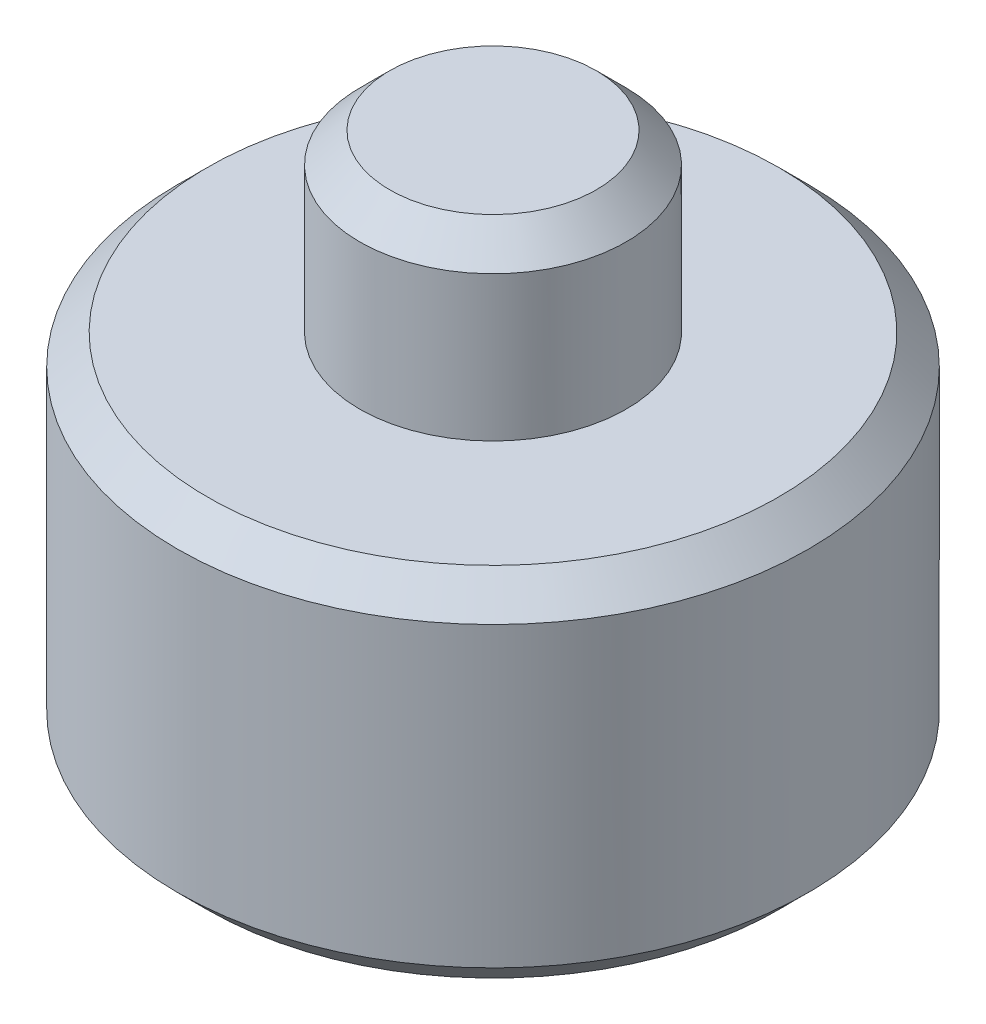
SolidWorks part; units mm, degrees
ref_plane "Front Plane" through (0, 0, 0) normal (0, 0, 1) x (1, 0, 0)
ref_plane "Top Plane" through (0, 0, 0) normal (0, 1, 0) x (1, 0, 0)
ref_plane "Right Plane" through (0, 0, 0) normal (1, 0, 0) x (0, 0, -1)
imported_body "Imported1"
other "Move Face1" parameters "D1"=5
other "DeleteFace1"
other "Move Face2" parameters "D1"=10
chamfer "Chamfer1" distance 3 angle 45 3 edges at (0, -5, 31.5389) (0, 30.7156, -31.5389) (0, 48.1926, -13.3232)
